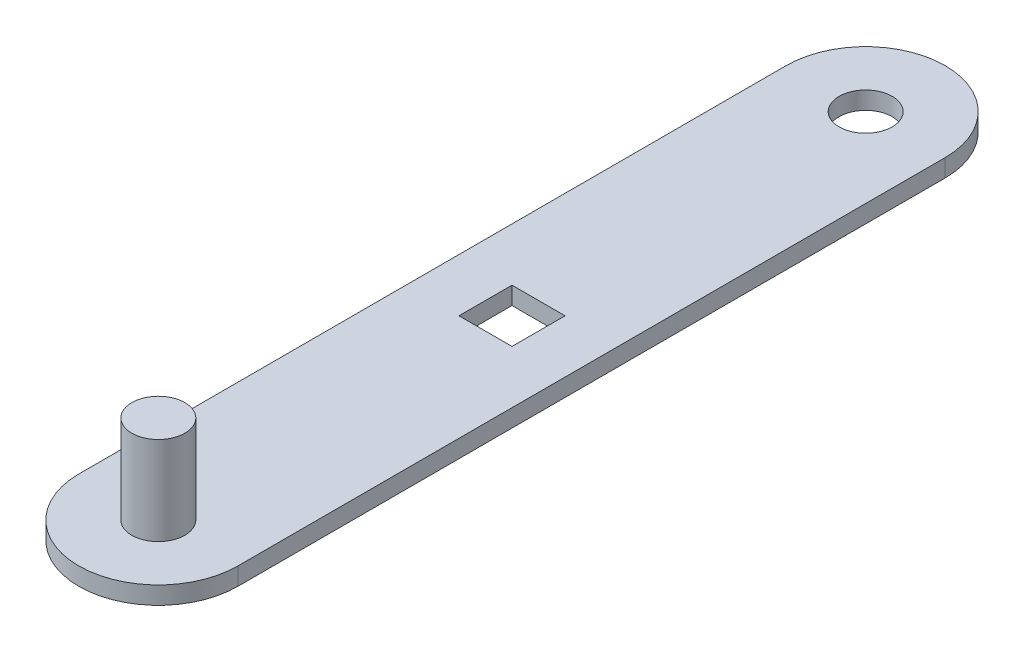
SolidWorks part; units mm, degrees
ref_plane "Front Plane" through (0, 0, 0) normal (0, 0, 1) x (1, 0, 0)
ref_plane "Top Plane" through (0, 0, 0) normal (0, 1, 0) x (1, 0, 0)
ref_plane "Right Plane" through (0, 0, 0) normal (1, 0, 0) x (0, 0, -1)
sketch "Sketch1" plane through (0, 0, 0) normal (0, 1, 0) x (1, 0, 0)
  line L1 (-225, -1000) -> (225, -1000)
  line L2 (-225, -1000) -> (-225, 1000)
  line L3 (-225, 1000) -> (225, 1000)
  line L4 (225, -1000) -> (225, 1000)
  line L5 (-225, -1000) -> (225, 1000) construction
  line L6 (-225, 1000) -> (225, -1000) construction
  arc A0 (225, -1000) -> (-225, -1000) centre (0, -1000) cw
  arc A1 (225, 1000) -> (-225, 1000) centre (0, 1000) ccw
  point P0 (0, 0)
  dimension "D1" = 2000
  dimension "D2" = 450
extrude "Boss-Extrude1" add sketch "Sketch1" along normal blind 50 contours L1 L4 L3 L2 | L3 A1 | A0 L1
sketch "Sketch2" plane through (0, 50, 0) normal (0, 1, 0) x (1, 0, 0)
  line L0 (-225, -1000) -> (225, -1000)
  line L1 (-225, -1000) -> (-225, 1000) construction
  circle A0 centre (0, -1000) radius 75
extrude "Boss-Extrude2" add sketch "Sketch2" along normal blind 250 contours L0 A0 | L0 A0
sketch "Sketch3" plane through (0, 50, 0) normal (0, 1, 0) x (1, 0, 0)
  line L0 (-225, 1000) -> (225, 1000)
  circle A0 centre (0, 1000) radius 75
extrude "Cut-Extrude2" cut sketch "Sketch3" against normal blind 250 contours L0 A0 | L0 A0
sketch "Sketch4" plane through (0, 50, 0) normal (0, 1, 0) x (1, 0, 0)
  line L1 (-75, -75) -> (75, -75)
  line L2 (-75, -75) -> (-75, 75)
  line L3 (-75, 75) -> (75, 75)
  line L4 (75, -75) -> (75, 75)
  line L5 (-75, -75) -> (75, 75) construction
  line L6 (-75, 75) -> (75, -75) construction
  point P0 (0, 0)
  dimension "D1" = 150
  dimension "D2" = 150
extrude "Cut-Extrude3" cut sketch "Sketch4" against normal through all
